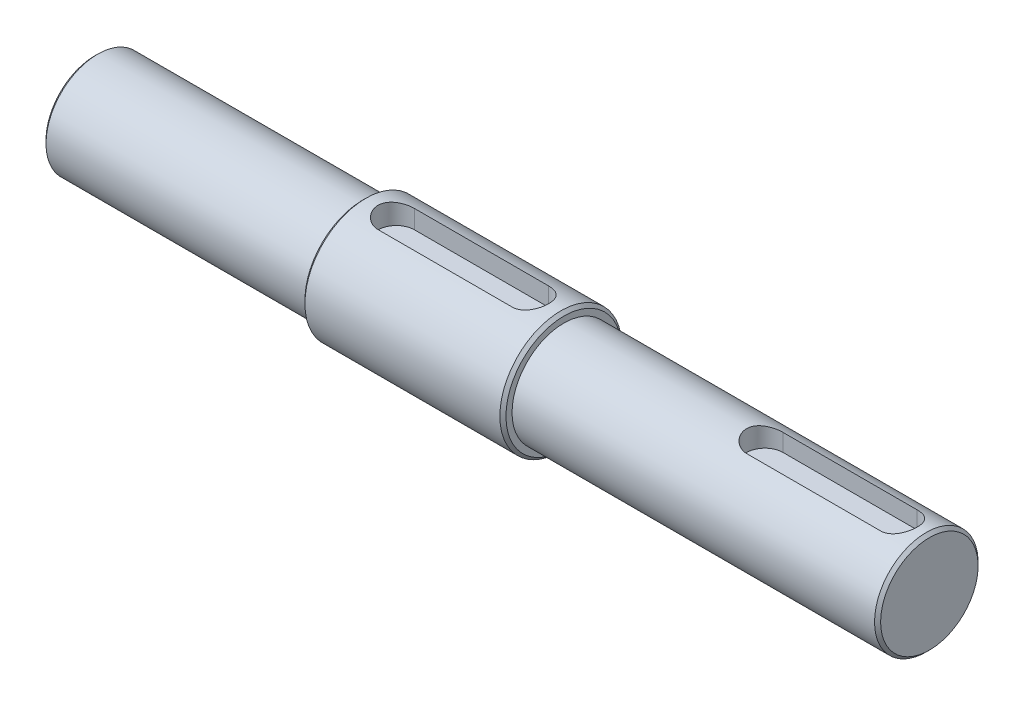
SolidWorks part; units mm, degrees
ref_plane "Front Plane" through (0, 0, 0) normal (0, 0, 1) x (1, 0, 0)
ref_plane "Top Plane" through (0, 0, 0) normal (0, 1, 0) x (1, 0, 0)
ref_plane "Right Plane" through (0, 0, 0) normal (1, 0, 0) x (0, 0, -1)
sketch "Sketch1" plane through (0, 0, 0) normal (0, 0, 1) x (1, 0, 0)
  line L0 (0, 0) -> (137, 0) construction
  line L1 (0, 0) -> (0, 8.5)
  line L2 (0, 8.5) -> (44, 8.5)
  line L3 (44, 8.5) -> (44, 10)
  line L4 (44, 10) -> (77, 10)
  line L5 (77, 10) -> (77, 8.5)
  line L6 (77, 8.5) -> (137, 8.5)
  line L7 (137, 8.5) -> (137, 0)
  line L8 (0, 0) -> (137, 0)
  dimension "D1" = 33
  dimension "D2" = 44
  dimension "D3" = 137
  dimension "D4" = 8.5
  dimension "D5" = 1.5
revolve "Revolve1" add sketch "Sketch1" angle 360 about L0
ref_plane "Plane1" through (0, 5.1, 0) normal (0, 1, 0) x (1, 0, 0)
sketch "Sketch2" plane through (0, 5.1, 0) normal (0, 1, 0) x (1, 0, 0)
  line L0 (132, 0) -> (110, 0) construction
  line L1 (132, -3) -> (110, -3)
  line L2 (132, 3) -> (110, 3)
  line L3 (137, -8.5) -> (137, 8.5) construction
  arc A0 (132, -3) -> (132, 3) centre (132, 0) ccw
  arc A1 (110, 3) -> (110, -3) centre (110, 0) ccw
  point P3 (121, 0)
  dimension "D1" = 5
  dimension "D2" = 22
  dimension "D3" = 6
extrude "Cut-Extrude1" cut sketch "Sketch2" along normal blind 10
ref_plane "Plane2" through (0, 6.5, 0) normal (0, 1, 0) x (1, 0, 0)
sketch "Sketch3" plane through (0, 6.5, 0) normal (0, 1, 0) x (1, 0, 0)
  line L0 (71.5, 0) -> (49.5, 0) construction
  line L1 (71.5, -3) -> (49.5, -3)
  line L2 (71.5, 3) -> (49.5, 3)
  line L3 (44, 10) -> (44, -10) construction
  arc A0 (71.5, -3) -> (71.5, 3) centre (71.5, 0) ccw
  arc A1 (49.5, 3) -> (49.5, -3) centre (49.5, 0) ccw
  point P3 (60.5, 0)
  dimension "D1" = 6
  dimension "D2" = 22
  dimension "D3" = 16.5
extrude "Cut-Extrude2" cut sketch "Sketch3" along normal blind 10
chamfer "Chamfer1" distance 0.5 angle 45 4 edges at (137, 0, 8.5) (0, 0, 8.5) (44, 0, 10) (77, 0, 10)
